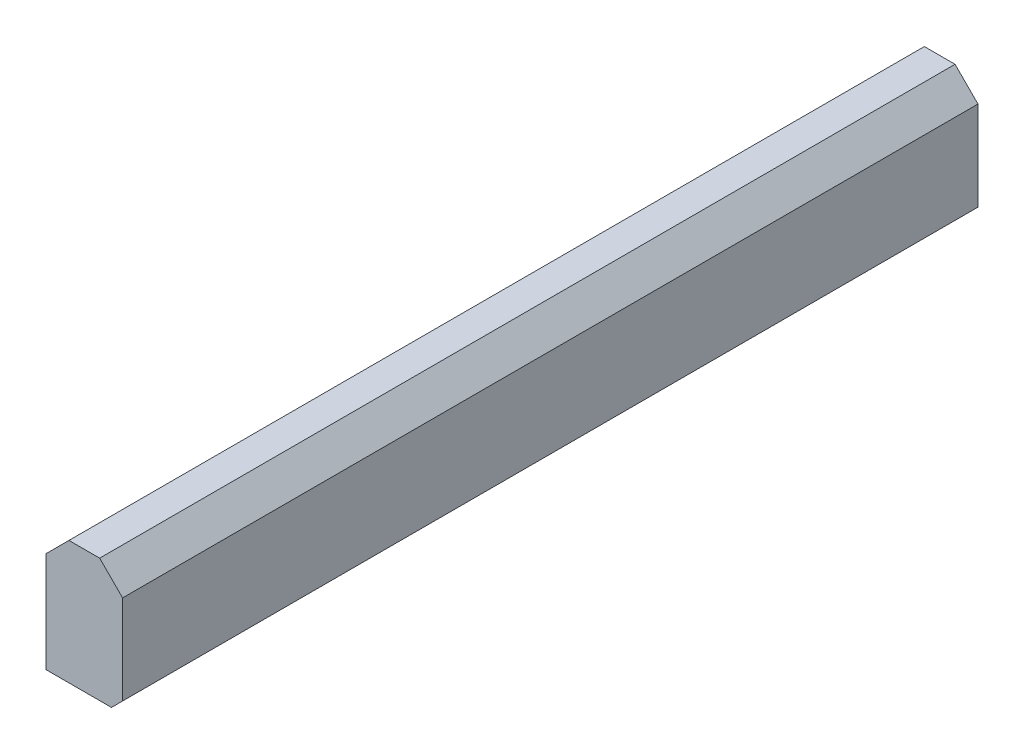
SolidWorks part; units mm, degrees
ref_plane "Front Plane" through (0, 0, 0) normal (1, 0, 0) x (0, 1, 0)
ref_plane "Top Plane" through (0, 0, 0) normal (0, 0, 1) x (0, 1, 0)
ref_plane "Right Plane" through (0, 0, 0) normal (0, 1, 0) x (-1, 0, 0)
sketch "sk w193" plane through (0, 0, 0) normal (0, 0, 1) x (0, 1, 0)
  point P0 (-199.517, -196.596)
  point P2 (0, -196.596)
  point P3 (11.303, 0)
  line B0 (-199.517, -196.596) -> (-199.517, -160.02)
  line B1 (-199.517, -160.02) -> (-26.543, -160.02)
  line B2 (-11.303, -144.78) -> (-11.303, 144.78)
  line B3 (-26.543, 160.02) -> (-199.517, 160.02)
  line B4 (-199.517, 160.02) -> (-199.517, 196.596)
  line B5 (-199.517, 196.596) -> (199.517, 196.596)
  line B6 (199.517, 196.596) -> (199.517, 160.02)
  line B7 (199.517, 160.02) -> (26.543, 160.02)
  line B8 (11.303, 144.78) -> (11.303, -144.78)
  line B9 (26.543, -160.02) -> (199.517, -160.02)
  line B10 (199.517, -160.02) -> (199.517, -196.596)
  line B11 (199.517, -196.596) -> (-199.517, -196.596)
  arc B12 (-26.543, -160.02) -> (-11.303, -144.78) centre (-26.543, -144.78) ccw
  arc B13 (-11.303, 144.78) -> (-26.543, 160.02) centre (-26.543, 144.78) ccw
  arc B14 (26.543, 160.02) -> (11.303, 144.78) centre (26.543, 144.78) ccw
  arc B15 (11.303, -144.78) -> (26.543, -160.02) centre (26.543, -144.78) ccw
sketch_block_instance "w14x193-2"
sketch_block "w14x193" parameters "D4"=15.24, "D1"=399.034, "D2"=393.192, "D3"=22.606, "D5"=36.576
sketch "Sketch2" plane through (0, 0, 0) normal (0, 0, 1) x (0, 1, 0)
  line L1 (-94.107, 58.42) -> (94.107, 58.42)
  line L2 (-94.107, 58.42) -> (-94.107, -58.42)
  line L3 (-94.107, -58.42) -> (94.107, -58.42)
  line L4 (94.107, 58.42) -> (94.107, -58.42)
  line L5 (-94.107, 58.42) -> (94.107, -58.42) construction
  line L6 (-94.107, -58.42) -> (94.107, 58.42) construction
  point P0 (0, 0)
  dimension "D1" = 116.84
  dimension "D2" = 188.214
extrude "Boss-Extrude1" add sketch "Sketch2" along normal mid plane 1304.568
chamfer "Chamfer1" distance 17 angle 45 1 edges at (58.42, -94.107, 0)
chamfer "Chamfer2" distance 35 angle 45 2 edges at (-58.42, 94.107, 0) (58.42, 94.107, 0)
